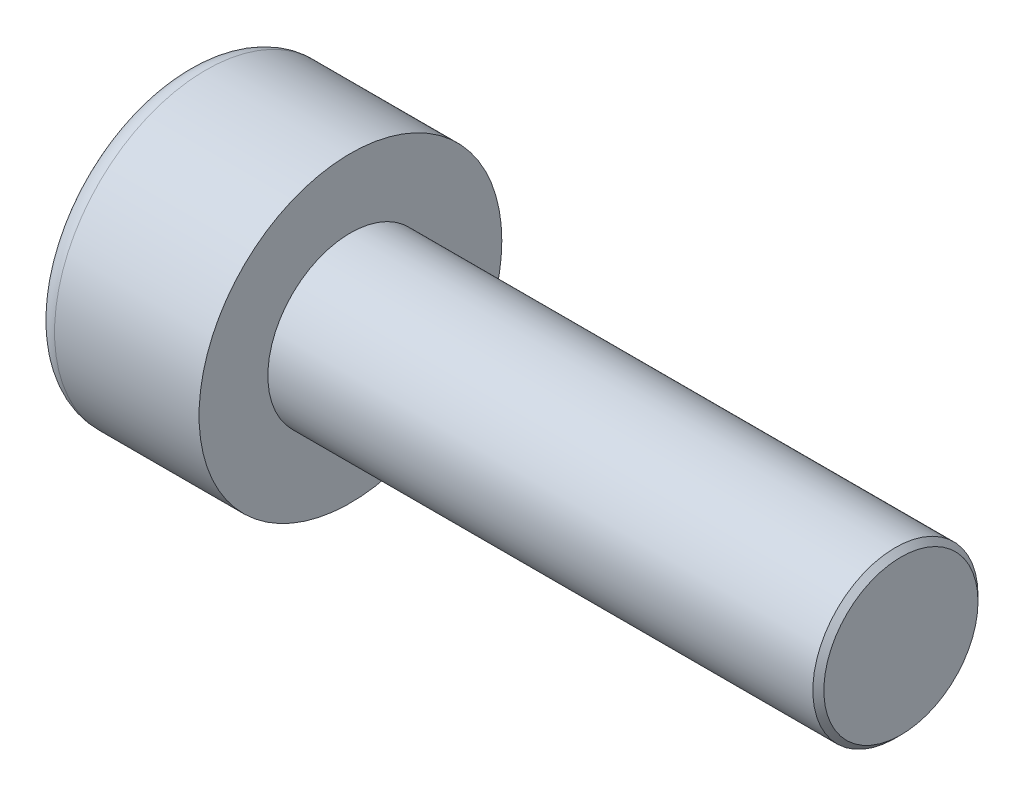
SolidWorks part; units mm, degrees
ref_plane "Front" through (0, 0, 0) normal (0, 0, 1) x (1, 0, 0)
ref_plane "Top" through (0, 0, 0) normal (0, 1, 0) x (1, 0, 0)
ref_plane "Right" through (0, 0, 0) normal (1, 0, 0) x (0, 0, -1)
other "Configuration Table"
sketch "Sketch1" plane through (0, 0, 0) normal (1, 0, 0) x (0, 0, -1)
  circle A0 centre (0, 0) radius 2.75
  dimension "dk" = 5.5
extrude "BaseHead" add sketch "Sketch1" along normal blind 3
sketch "Sketch2" plane through (3, 0, 0) normal (1, 0, 0) x (0, 0, -1)
  circle A0 centre (0, 0) radius 1.5
extrude "BaseBody" add sketch "Sketch2" along normal blind 10
sketch "Sketch3" plane through (0, 0, 0) normal (1, 0, 0) x (0, 0, -1)
  line L1 (1.4434, 0) -> (0.7217, 1.25)
  line L2 (0.7217, 1.25) -> (-0.7217, 1.25)
  line L3 (-0.7217, 1.25) -> (-1.4434, 0)
  line L4 (-1.4434, 0) -> (-0.7217, -1.25)
  line L5 (-0.7217, -1.25) -> (0.7217, -1.25)
  line L6 (0.7217, -1.25) -> (1.4434, 0)
  circle A0 centre (0, 0) radius 1.25 construction
  dimension "s" = 2.5
  dimension "e" = 2.8868
extrude "HexagonSocket" cut sketch "Sketch3" along normal blind 1.3
sketch "Sketch4" plane through (-4.1961, 0.75, 0) normal (0, 0, 1) x (-1, 0, 0)
  line L0 (-5.4961, 2) -> (-6.2178, 0.75)
  line L2 (-6.2178, 0.75) -> (-5.4961, 0.75)
  line L3 (-5.4961, 0.75) -> (-5.4961, 2)
  line L4 (-5.0351, 0.75) -> (0.839, 0.75) construction
  line L5 (-17.1961, 0.75) -> (-7.1961, 0.75) construction
  line L6 (-7.1961, 0.75) -> (-4.1961, 0.75) construction
  dimension "m" = 60
revolve "Cut-Revolve1" cut sketch "Sketch4" angle 360 about L4
fillet "HeadFillet" [suppressed] radius 0.1
fillet "TopFillet" radius 0.375 1 edges at (0, 0, -2.75)
chamfer "Chamfer1" distance 0.1 angle 45 1 edges at (13, 0, -1.5)
sketch "Sketch5" plane through (0, 0, 0) normal (0, 0, 1) x (1, 0, 0)
  line L0 (12.9, 1.2657) -> (13.0352, 1.5)
  line L1 (13.0352, 1.5) -> (13.0352, 1.7705)
  line L2 (13.0352, 1.7705) -> (12.7647, 1.7705)
  line L3 (12.7647, 1.7705) -> (12.7647, 1.5)
  line L4 (12.7647, 1.5) -> (12.9, 1.2657)
  line L5 (0, 0) -> (7.8886, 0) construction
  line L6 (12.9, -1.5) -> (12.9, 1.5) construction
revolve "Cut-Revolve10" [suppressed] cut sketch "Sketch5" angle 360 about L5
pattern_linear "LPattern10" [suppressed] count 31 spacing 0.3246 along (1, 0, 0)
equation "\"r1@TopFillet\" = \"d@Sketch2\" / 8"
equation "\"D1@Chamfer1\" = \"r@HeadFillet\""
equation "\"D1@Sketch5\" = \"d@Sketch2\""
equation "\"D2@Sketch5\" =  ( \"d@Sketch2\" - \"D2@ThreadCosmetic1\" )  / 2"
equation "\"D3@LPattern10\" = \"D2@Sketch5\" * 1.2"
equation "\"D1@LPattern10\" = \"b@ThreadCosmetic1\" / \"D3@LPattern10\""
